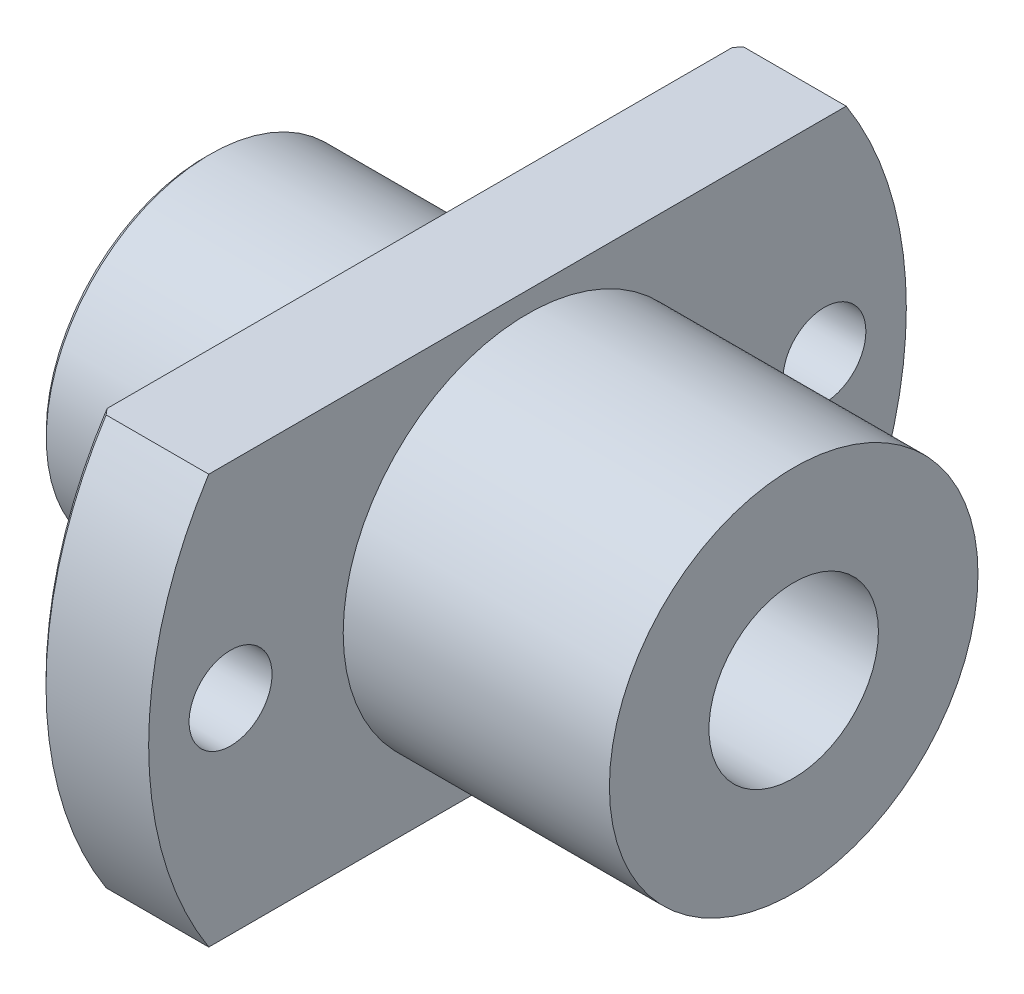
SolidWorks part; units mm, degrees
ref_plane "Plan de face" through (0, 0, 0) normal (0, 0, 1) x (1, 0, 0)
ref_plane "Plan de dessus" through (0, 0, 0) normal (0, 1, 0) x (1, 0, 0)
ref_plane "Plan de droite" through (0, 0, 0) normal (1, 0, 0) x (0, 0, -1)
sketch "Esquisse2" plane through (0, 0, 0) normal (0, 0, 1) x (1, 0, 0)
  line L0 (-39.9719, 0) -> (97.2999, 0) construction
  line L1 (0, 0) -> (60, 0)
  line L2 (0, 0) -> (0, 40)
  line L3 (0, 40) -> (60, 40)
  line L4 (60, 0) -> (60, 40)
  dimension "D1" = 80
  dimension "D2" = 60
revolve "Révolution1" add sketch "Esquisse2" angle 360 about L0
sketch "Esquisse8" plane through (0, 0, 0) normal (0, 0, 1) x (1, 0, 0)
  line L0 (-12.5108, 0) -> (75.6947, 0) construction
  line L1 (33, 46.031) -> (33, 18)
  line L2 (33, 18) -> (59, 18)
  line L3 (59, 18) -> (59, 0)
  line L4 (59, 0) -> (67.631, 0)
  line L5 (67.631, 0) -> (67.631, 50.3229)
  line L6 (67.631, 50.3229) -> (33, 46.031)
  line L8 (60, -40) -> (60, 40) construction
  dimension "D1" = 36
  dimension "D2" = 1
  dimension "D3" = 26
revolve "Enlèvement de matière-Révolution2" cut sketch "Esquisse8" angle 360 about L0
sketch "Esquisse9" plane through (59, 0, 0) normal (1, 0, 0) x (0, 0, -1)
  circle A0 centre (0, 0) radius 8.275
  circle A1 centre (0, 0) radius 18 construction
  dimension "D1" = 16.55
extrude "Enlèv. mat.-Extru.1" cut sketch "Esquisse9" against normal through all
sketch "Esquisse10" plane through (0, 0, 0) normal (0, 0, 1) x (1, 0, 0)
  line L0 (35.3128, 37) -> (22.475, 37)
  line L1 (22.475, 37) -> (22.475, 16)
  line L2 (22.475, 16) -> (1.5, 16)
  line L3 (1.5, 16) -> (1.5, 9.01)
  line L4 (1.5, 9.01) -> (16.5, 9.01)
  line L5 (16.5, 9.01) -> (16.5, 0)
  line L7 (16.5, 0) -> (-6.9066, 0)
  line L8 (-6.9066, 0) -> (-6.9066, 43.7491)
  line L9 (-6.9066, 43.7491) -> (35.3128, 43.7491)
  line L10 (35.3128, 43.7491) -> (35.3128, 37)
  line L11 (71.8724, 0) -> (-25.2629, 0) construction
  line L12 (0, 40) -> (0, -40) construction
  dimension "D1" = 18.02
  dimension "D2" = 32
  dimension "D3" = 74
  dimension "D4" = 1.5
  dimension "D5" = 20.975
  dimension "D6" = 15
revolve "Enlèvement de matière-Révolution3" cut sketch "Esquisse10" angle 360 about L11
chamfer "Chanfrein1" distance 0.2 angle 45 2 edges at (1.5, 0, -9.01) (16.5, 0, -8.275)
chamfer "Chanfrein2" distance 0.5 angle 45 1 edges at (1.5, 0, -16)
fillet "Congé1" radius 0.4 1 edges at (22.475, 0, -16)
chamfer "Chanfrein3" distance 0.5 angle 45 1 edges at (22.475, 0, -37)
sketch "Esquisse11" plane through (22.475, 0, 0) normal (-1, 0, 0) x (0, 0, 1)
  line L0 (-44.8543, 0) -> (48.2502, 0) construction
  line L1 (-34.5251, 41.1754) -> (38.5946, 41.1754)
  line L2 (-34.5251, 41.1754) -> (-34.5251, 20)
  line L3 (-34.5251, 20) -> (38.5946, 20)
  line L4 (38.5946, 41.1754) -> (38.5946, 20)
  line L5 (-39.053, -20) -> (44.8543, -20)
  line L6 (-39.053, -20) -> (-39.053, -41.4584)
  line L7 (-39.053, -41.4584) -> (44.8543, -41.4584)
  line L8 (44.8543, -20) -> (44.8543, -41.4584)
  dimension "D1" = 20
  dimension "D2" = 40
extrude "Enlèv. mat.-Extru.2" cut sketch "Esquisse11" against normal through all
sketch "Esquisse12" plane through (22.475, 0, 0) normal (-1, 0, 0) x (0, 0, 1)
  line L0 (-39.471, 0) -> (39.3617, 0) construction
  point P3 (-29, 0)
  point P4 (29, 0)
  dimension "D1" = 58
  dimension "D2" = 29
hole_wizard "Diamètre du perçage Ø8.1 (8.1)1" positions "Esquisse3D1" profile "Esquisse13" hole size "Ø8.1" standard "ISO"
sketch3d "Esquisse3D1"
  point P0 (22.475, 0, -29)
  point P3 (22.475, 0, 29)
sketch "Esquisse13" plane through (22.475, 0, -29) normal (0, 1, 0) x (0, 0, 1)
  line L0 (0, 0) -> (0, 16.05)
  line L1 (0, 16.05) -> (4.05, 12)
  line L2 (4.05, 12) -> (4.05, 0)
  line L5 (4.05, 0) -> (0, 0)
  line L10 (0, 16.05) -> (-4.05, 12) construction
  line L11 (0, -6.35) -> (0, 107.95) construction
  dimension "Diamètre du perçage" = 8.1
  dimension "Profondeur du perçage" = 12
  dimension "Angle de pointe" = 90
chamfer "Chanfrein4" distance 0.2 angle 45 2 edges at (22.475, 0, 33.05) (22.475, 0, -24.95)
sketch "Esquisse14" [suppressed] plane through (0, 0, 0) normal (0, 0, 1) x (1, 0, 0)
  line L0 (30.025, 49.2345) -> (30.025, 17.5)
  line L1 (30.025, 17.5) -> (55, 17.5)
  line L2 (55, 17.5) -> (55, 11)
  line L3 (56, 9.01) -> (41, 9.01)
  line L4 (41, 9.01) -> (41, 0)
  line L5 (41, 0) -> (63.4973, 0)
  line L6 (63.4973, 0) -> (63.4973, 51.5834)
  line L7 (63.4973, 51.5834) -> (30.025, 49.2345)
  line L8 (-7.333, 0) -> (72.2372, 0) construction
  line L9 (22.475, 20) -> (22.475, -20) construction
  line L11 (55, 11) -> (56, 10.4226)
  line L12 (56, 10.4226) -> (56, 9.01)
  line L13 (1.5, 15.5) -> (1.5, -15.5) construction
  dimension "D1" = 18.02
  dimension "D2" = 54.5
  dimension "D3" = 7.55
  dimension "D4" = 1
  dimension "D5" = 35
  dimension "D6" = 30
  dimension "D7" = 22
revolve "Enlèvement de matière-Révolution4" [suppressed] cut sketch "Esquisse14" angle 360 about L8
chamfer "Chanfrein5" [suppressed] distance 0.5 angle 45
chamfer "Chanfrein6" [suppressed] distance 0.2 angle 45
fillet "Congé2" [suppressed] radius 0.4
chamfer "Chanfrein7" [suppressed] distance 0.2 angle 45
chamfer "Chanfrein8" [suppressed] distance 0.5 angle 45
chamfer "Chanfrein9" [suppressed] distance 0.5 angle 45
chamfer "Chanfrein10" [suppressed] distance 0.5 angle 45
